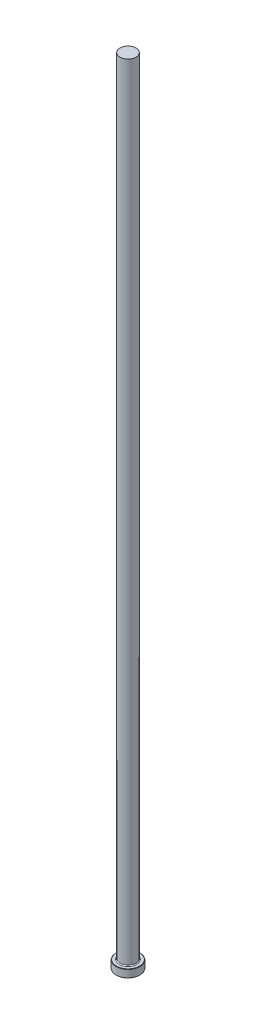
SolidWorks part; units mm, degrees
ref_plane "Front Plane" through (0, 0, 0) normal (0, 0, 1) x (1, 0, 0)
ref_plane "Top Plane" through (0, 0, 0) normal (0, 1, 0) x (1, 0, 0)
ref_plane "Right Plane" through (0, 0, 0) normal (1, 0, 0) x (0, 0, -1)
sketch "Sketch1" plane through (0, 0, 0) normal (0, 0, 1) x (1, 0, 0)
  line L0 (0, 259.9588) -> (0, -15.1925) construction
  line L1 (0, 0) -> (-9.525, 0)
  line L2 (-9.525, 0) -> (-9.525, 6.35)
  line L3 (-9.525, 6.35) -> (-6.4135, 6.35)
  line L4 (-6.4135, 6.35) -> (-6.4135, 635)
  line L5 (-6.4135, 635) -> (0, 635)
  line L6 (0, 635) -> (0, 0)
  dimension "L" = 635
  dimension "H" = 19.05
  dimension "T" = 6.35
  dimension "D" = 12.827
revolve "Revolve1" add sketch "Sketch1" angle 360 about L0
chamfer "Chamfer1" distance 0.254 angle 45 2 edges at (0, 6.35, 9.525) (0, 0, 9.525)
fillet "Fillet1" radius 0.762 1 edges at (0, 6.35, 6.4135)
sketch "Pocket Sketch" plane through (0, 0, 0) normal (0, 0, 1) x (1, 0, 0)
  line L0 (-9.9219, 0) -> (-9.9219, 6.3754)
  line L1 (-9.9219, 6.3754) -> (-7.5724, 6.3754)
  line L2 (-6.8104, 7.1374) -> (-6.8104, 22.225)
  line L3 (-6.8104, 22.225) -> (0, 22.225)
  line L4 (0, 22.225) -> (0, 0)
  line L5 (0, 0) -> (-9.9219, 0)
  line L6 (0, 12.6104) -> (0, -2.4989) construction
  line L7 (-9.525, 6.096) -> (-9.525, 0.254) construction
  line L8 (9.271, 6.35) -> (-9.271, 6.35) construction
  line L9 (-6.4135, 635) -> (-6.4135, 7.112) construction
  line L10 (-7.5724, 6.3754) -> (-6.8104, 7.1374)
  point P3 (-6.8104, 6.3754)
  dimension "D1" = 19.8437
  dimension "D2" = 0.3969
  dimension "D3" = 0.0254
  dimension "D4" = 0.3969
  dimension "D5" = 13.6207
  dimension "D6" = 22.225
